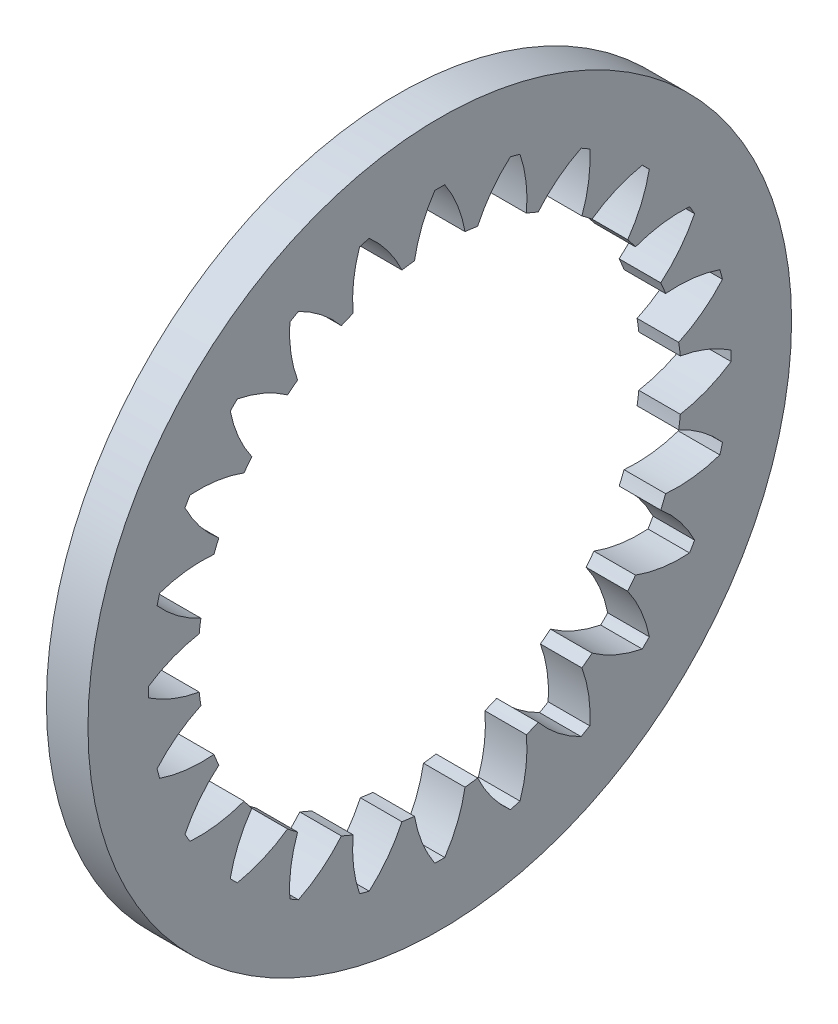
SolidWorks part; units mm, degrees
ref_plane "Plane1" through (0, 0, 0) normal (0, 0, 1) x (1, 0, 0)
ref_plane "Plane2" through (0, 0, 0) normal (0, 1, 0) x (1, 0, 0)
ref_plane "Plane3" through (0, 0, 0) normal (1, 0, 0) x (0, 0, -1)
sketch "HoldingSke" plane through (0, 0, 0) normal (0, 1, 0) x (1, 0, 0)
  line L0 (0, 0) -> (-0.0273, -0.1551)
  line L1 (-15, 0) -> (100, 0) construction
  line L2 (0, 0) -> (-2.1039, 2.3779)
  line L3 (0, 0) -> (-11.863, 4.5341)
  line L4 (0, 0) -> (7.8894, 3.5126)
  line L5 (0, 0) -> (-23.7986, -8.8762)
  line L6 (0, 0) -> (-10.5278, -7.1032)
  line L7 (-2.1039, 2.3779) -> (3.3635, 27.1825)
  line L8 (-76.2, 8.7279) -> (-54.61, 8.7279)
  line L9 (-67.7845, 28.3722) -> (-49.3413, 33.142)
  line L10 (-76.2, 71.12) -> (104.1128, 71.12)
  line L11 (0, 0) -> (-12, 0)
  line L12 (-76.2, 101.6) -> (-75.9714, 101.6)
  line L13 (24.9733, 27.94) -> (52.9518, 28.4284)
  line L14 (24.9733, 27.94) -> (24.9746, 27.94)
  line L15 (24.9733, 27.94) -> (100.4006, 29.5858)
  circle A0 centre (0, 0) radius 101.6
  circle A1 centre (0, 0) radius 12.7
  circle A2 centre (0, 0) radius 12.7
  dimension "MHD" = 25.4
  dimension "Hub_dia" = 25.4
  dimension "Diameter" = 203.2
  dimension "Num_teeth" = 24
  dimension "Pitch_radius" = 180.3128
  dimension "Pitch" = 0.1575
  dimension "Width" = 12
  dimension "Overall_len" = 25.4
  dimension "Show_teeth" = 100
  dimension "Thickness" = 12.7
  dimension "OAL" = 25.4001
  dimension "T_dim" = 21.59
  dimension "Ap" = 14.5
  dimension "H" = 19.05
  dimension "Backlash" = 0.2286
  dimension "Addendum_fac" = 1
  dimension "Dedendum_fac" = 1.25
  dimension "Clearance_fac" = 0.25
  dimension "Dedendum_add" = 0.0013
  dimension "Module" = 6.35
sketch "BasProSke" plane through (0, 0, 0) normal (0, 1, 0) x (1, 0, 0)
  line L0 (-10, 0) -> (60, 0) construction
  line L1 (0, 69.85) -> (0, 101.6)
  line L2 (0, 69.85) -> (12, 69.85)
  line L3 (12, 69.85) -> (12, 101.6)
  line L4 (12, 101.6) -> (0, 101.6)
  dimension "Diameter" = 203.2
  dimension "Thickness" = 12
  dimension "Inside_diameter" = 139.7
revolve "Base-Revolve" add sketch "BasProSke" angle 360 about L0
sketch "TooCutSke" plane through (0, 0, 0) normal (1, 0, 0) x (0, 0, -1)
  line L3 (5.5552, 75.9972) -> (5.5552, 53.6633) construction
  line L4 (0, 0) -> (0, 59.563) construction
  line L5 (0, 0) -> (-8.9185, 67.7429) construction
  line L6 (-30.2541, 62.9855) -> (28.8527, 70.767) construction
  circle A0 centre (0, 0) radius 76.2 construction
  circle A1 centre (0, 0) radius 84.1388 construction
  circle A2 centre (0, 0) radius 66.3956 construction
  circle A3 centre (0, 0) radius 69.8246 construction
  arc A4 (7.2948, 69.4425) -> (1.4425, 84.1264) centre (-30.2541, 62.9855) ccw
  arc A5 (7.2948, 69.4425) -> (-7.2948, 69.4425) centre (0, 0) ccw
  arc A6 (1.4425, 84.1264) -> (-1.4425, 84.1264) centre (0, 0) ccw
  arc A7 (-1.4425, 84.1264) -> (-7.2948, 69.4425) centre (30.2541, 62.9855) ccw
  dimension "Pitch_dia" = 152.4
  dimension "Base_dia" = 132.7911
  dimension "Root_dia" = 168.2775
  dimension "Overcut_dia" = 139.6492
  dimension "Flank_rad" = 38.1
  dimension "Half_ang" = 7.5
  dimension "Half_CT" = 5.5552
extrude "ToothCut" cut sketch "TooCutSke" along normal through all
fillet "Breaks" [suppressed] radius 0.635
fillet "RootFillets" [suppressed] radius 1.5888
pattern_circular "TeethCuts" count 24 every 15 about axis through (-10, 0, 0) along (1, 0, 0) of "RootFillets", "Breaks", "ToothCut"
equation "' \"Module@HoldingSke\" = 6.35"
equation "' \"Num_teeth@HoldingSke\" = 24"
equation "' \"Ap@HoldingSke\" =  14.5"
equation "' \"Width@HoldingSke\" = 12"
equation "' \"Diameter@HoldingSke\" = 8 * 25.4"
equation "' \"Show_teeth@HoldingSke\" = 100"
equation "' \"Backlash@HoldingSke\" = 0.009 * 25.4"
equation "' \"Addendum_fac@HoldingSke\" = 1.0"
equation "' \"Dedendum_fac@HoldingSke\" = 1.25"
equation "' \"Dedendum_add@HoldingSke\" = 0.00005 * 25.4"
equation "' \"Clearance_fac@HoldingSke\" = 0.25"
equation "\"Pitch@HoldingSke\" = 1 / \"Module@HoldingSke\" "
equation "\"Overcut_dia@TooCutSke\" = (\"Num_teeth@HoldingSke\" - 2 * \"Addendum_fac@HoldingSke\") / \"Pitch@HoldingSke\" - 0.002 * 25.4"
equation "\"Pitch_dia@TooCutSke\" = \"Num_teeth@HoldingSke\" / \"Pitch@HoldingSke\""
equation "\"Base_dia@TooCutSke\" = \"Num_teeth@HoldingSke\" / \"Pitch@HoldingSke\" * cos((\"Ap@HoldingSke\"  * 3.14159265 / 180)) * 0.90"
equation "\"Root_dia@TooCutSke\" = \"Num_teeth@HoldingSke\"  / \"Pitch@HoldingSke\" + 2 *  \"Dedendum_fac@HoldingSke\"/ \"Pitch@HoldingSke\" + \"Dedendum_add@HoldingSke\" * 2"
equation "\"Half_ang@TooCutSke\" = 180 / \"Num_teeth@HoldingSke\""
equation "\"Half_CT@TooCutSke\" = \"Num_teeth@HoldingSke\" / \"Pitch@HoldingSke\" * sin((3.14159265 / 2 / \"Num_teeth@HoldingSke\")) / 2 + 10 * \"Backlash@HoldingSke\" / 4"
equation "\"Flank_rad@TooCutSke\" = \"Num_teeth@HoldingSke\" / \"Pitch@HoldingSke\" / 4"
equation "\"Radius@RootFillets\"= \"Clearance_fac@HoldingSke\" / \"Pitch@HoldingSke\" + \"Dedendum_add@HoldingSke\""
equation "\"Break_rad@Breaks\" = 0.02 / \"Pitch@HoldingSke\" * 5"
equation "\"Num_teeth@TeethCuts\" = int( \"Show_teeth@HoldingSke\" ) + 1"
equation "\"Num_teeth@TeethCuts\" = ((sgn( \"Num_teeth@TeethCuts\" - \"Num_teeth@HoldingSke\" )-1)*( \"Num_teeth@TeethCuts\" - \"Num_teeth@HoldingSke\" ))/-2+ \"Num_teeth@HoldingSke\""
equation "\"Num_teeth@TeethCuts\" = ((sgn( \"Num_teeth@TeethCuts\" - 2.0)+1)*( \"Num_teeth@TeethCuts\" - 2.0))/2 +2.0"
equation "\"Angle@TeethCuts\" = 360.0 / \"Num_teeth@HoldingSke\""
equation "\"Diameter@BasProSke\" = \"Num_teeth@HoldingSke\"  / \"Pitch@HoldingSke\" + 2 *  \"Dedendum_fac@HoldingSke\"/ \"Pitch@HoldingSke\" + \"Dedendum_add@HoldingSke\" * 2 + 0.002 * 25.4"
equation "\"Diameter@BasProSke\" = ((sgn( \"Diameter@BasProSke\"  - \"Diameter@HoldingSke\" )+1)*( \"Diameter@BasProSke\"  - \"Diameter@HoldingSke\" ))/2 + \"Diameter@HoldingSke\""
equation "\"Inside_diameter@BasProSke\" =  (\"Num_teeth@HoldingSke\" - 2 * \"Addendum_fac@HoldingSke\") / \"Pitch@HoldingSke\" "
equation "\"Thickness@BasProSke\"  = \"Width@HoldingSke\""
